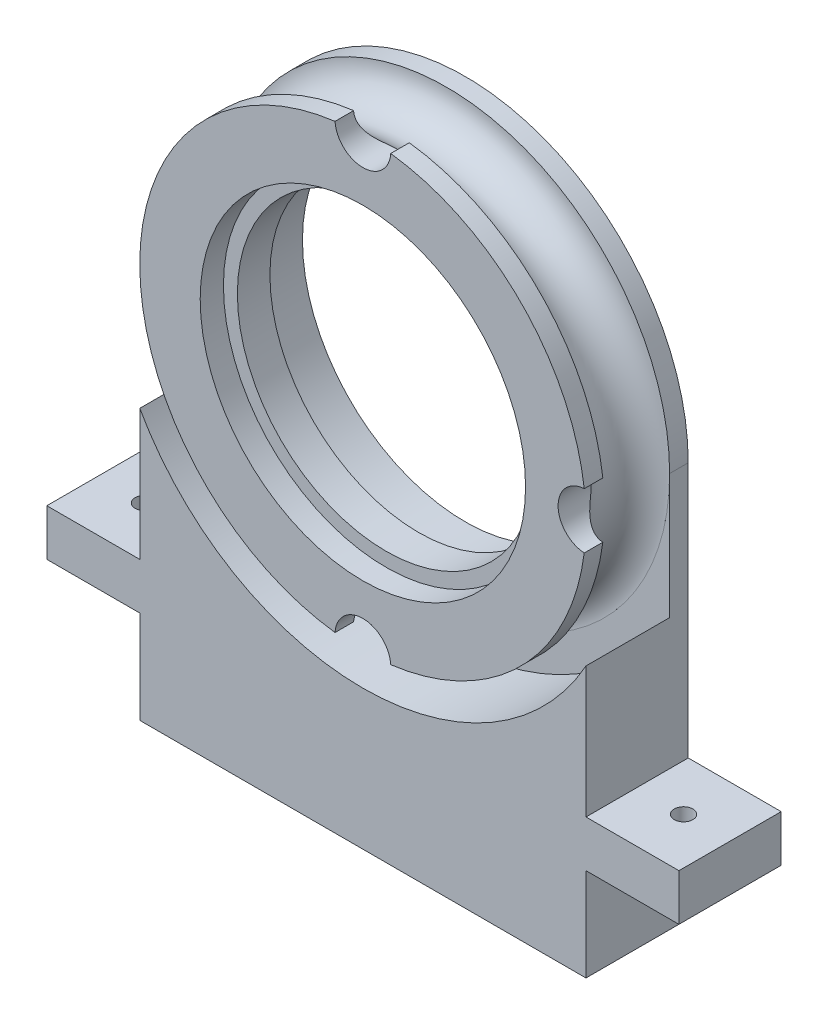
SolidWorks part; units mm, degrees
ref_plane "Front Plane" through (0, 0, 0) normal (0, 0, 1) x (1, 0, 0)
ref_plane "Top Plane" through (0, 0, 0) normal (0, 1, 0) x (1, 0, 0)
ref_plane "Right Plane" through (0, 0, 0) normal (1, 0, 0) x (0, 0, -1)
sketch "Sketch1" plane through (0, 0, 0) normal (0, 0, 1) x (1, 0, 0)
  line L0 (-34, -27.5) -> (-34, -32.5)
  line L1 (24, -27.5) -> (34, -27.5)
  line L2 (24, -27.5) -> (24, 0)
  line L3 (-24, 0) -> (-24, -27.5)
  line L4 (-24, -27.5) -> (-34, -27.5)
  line L5 (34, -27.5) -> (34, -32.5)
  line L6 (-34, -32.5) -> (-24, -32.5)
  line L7 (34, -32.5) -> (24, -32.5)
  line L8 (-24, -32.5) -> (-24, -42.5)
  line L9 (24, -32.5) -> (24, -42.5)
  line L10 (-24, -42.5) -> (24, -42.5)
  line L11 (0, 0) -> (0, -22.5) construction
  circle A0 centre (0, 0) radius 17.5
  arc A1 (24, 0) -> (-24, 0) centre (0, 0) ccw
  dimension "D1" = 35
  dimension "D2" = 24
  dimension "D3" = 48
  dimension "D4" = 10
  dimension "D5" = 10
  dimension "D6" = 5
  dimension "D7" = 10
  dimension "D8" = 10
  dimension "D9" = 5
  dimension "D10" = 22.5
extrude "Boss-Extrude1" add sketch "Sketch1" along normal blind 11
sketch "Sketch3" plane through (0, 0, 0) normal (0, 0, -1) x (-1, 0, 0)
  circle A0 centre (0, 0) radius 24
  circle A1 centre (0, 0) radius 16
  circle A2 centre (0, 0) radius 24
extrude "Boss-Extrude3" add sketch "Sketch3" against normal blind 8.5 contours A1 | A0
sketch "Sketch4" plane through (0, 0, 8.5) normal (0, 0, 1) x (1, 0, 0)
  circle A0 centre (0, 0) radius 24
  circle A1 centre (0, 0) radius 19
extrude "Boss-Extrude4" add sketch "Sketch4" against normal blind 3
sketch "Sketch6" plane through (0, 0, 11) normal (0, 0, 1) x (1, 0, 0)
  line L0 (0, 24) -> (0, -24) construction
  line L6 (0, 24) -> (0, 21) construction
  arc A0 (24, 0) -> (-24, 0) centre (0, 0) ccw construction
  arc A2 (-2.9941, 23.8125) -> (2.9941, 23.8125) centre (0, 24) ccw
  arc A3 (2.9941, 23.8125) -> (-2.9941, 23.8125) centre (0, 0) ccw
  arc A4 (23.8125, 2.9941) -> (23.8125, -2.9941) centre (24, 0) ccw
  arc A5 (2.9941, -23.8125) -> (-2.9941, -23.8125) centre (0, -24) ccw
  arc A6 (23.8125, -2.9941) -> (23.8125, 2.9941) centre (0, 0) ccw
  arc A7 (-2.9941, -23.8125) -> (2.9941, -23.8125) centre (0, 0) ccw
  dimension "D1" = 3
extrude "Cut-Extrude1" cut sketch "Sketch6" against normal blind 7
sketch "Croquis1" plane through (0, 0, 0) normal (0, 0, -1) x (-1, 0, 0)
  circle A0 centre (0, 0) radius 17.5
extrude "Cortar-Extruir1" cut sketch "Croquis1" against normal blind 5
sketch "Croquis3" plane through (0, -27.5, 0) normal (0, 1, 0) x (1, 0, 0)
  line L0 (-34, -5.5) -> (-24, -5.5) construction
  line L1 (-34, -11) -> (-34, 0) construction
  line L2 (-24, -11) -> (-24, 0) construction
  line L3 (34, -5.5) -> (24, -5.5) construction
  line L4 (34, -11) -> (34, 0) construction
  line L5 (24, -11) -> (24, 0) construction
  circle A0 centre (-29, -5.5) radius 1
  circle A1 centre (29, -5.5) radius 1
extrude "Cortar-Extruir3" cut sketch "Croquis3" against normal blind 10
sketch "Croquis17" plane through (0, 0, 0) normal (0, 1, 0) x (1, 0, 0)
  line L0 (0, 0) -> (0, -11) construction
  line L1 (-1, -11) -> (1, -11) construction
  line L2 (23.91, -5.5) -> (0, -5.5) construction
  circle A0 centre (23.91, -5.5) radius 3.5
  dimension "D1" = 7
  dimension "D2" = 23.91
revolve "Cortar-Revolución2" cut sketch "Croquis17" angle 360 about L0
sketch "Croquis18" plane through (0, 0, 11) normal (0, 0, 1) x (1, 0, 0)
  line L0 (-24, 0) -> (-24, -13.4257)
  line L1 (-24, 0) -> (-24, -27.5) construction
  line L2 (24, 0) -> (24, -13.4257)
  arc A0 (-24, 0) -> (24, 0) centre (0, 0) ccw
  arc A1 (-24, -13.4257) -> (24, -13.4257) centre (0, 0) ccw
extrude "Cortar-Extruir4" cut sketch "Croquis18" against normal blind 9
sketch "Croquis19" plane through (0, 0, 0) normal (1, 0, 0) x (0, 0, -1)
  line L0 (0, 36.575) -> (0, -36.575) construction
sketch "Croquis21" plane through (0, 0, 0) normal (1, 0, 0) x (0, 0, -1)
  line L0 (-2.0012, 23.9904) -> (-5.5, 23.9904) construction
  line L1 (-5.5, 20.41) -> (-5.5, 23.9904) construction
  line L2 (-2.0012, 24) -> (-2.0012, -24) construction
  arc A0 (-7.4454, 21.0005) -> (-2, 23.91) centre (-5.5, 23.91) ccw construction
  point P2 (0, 0)
